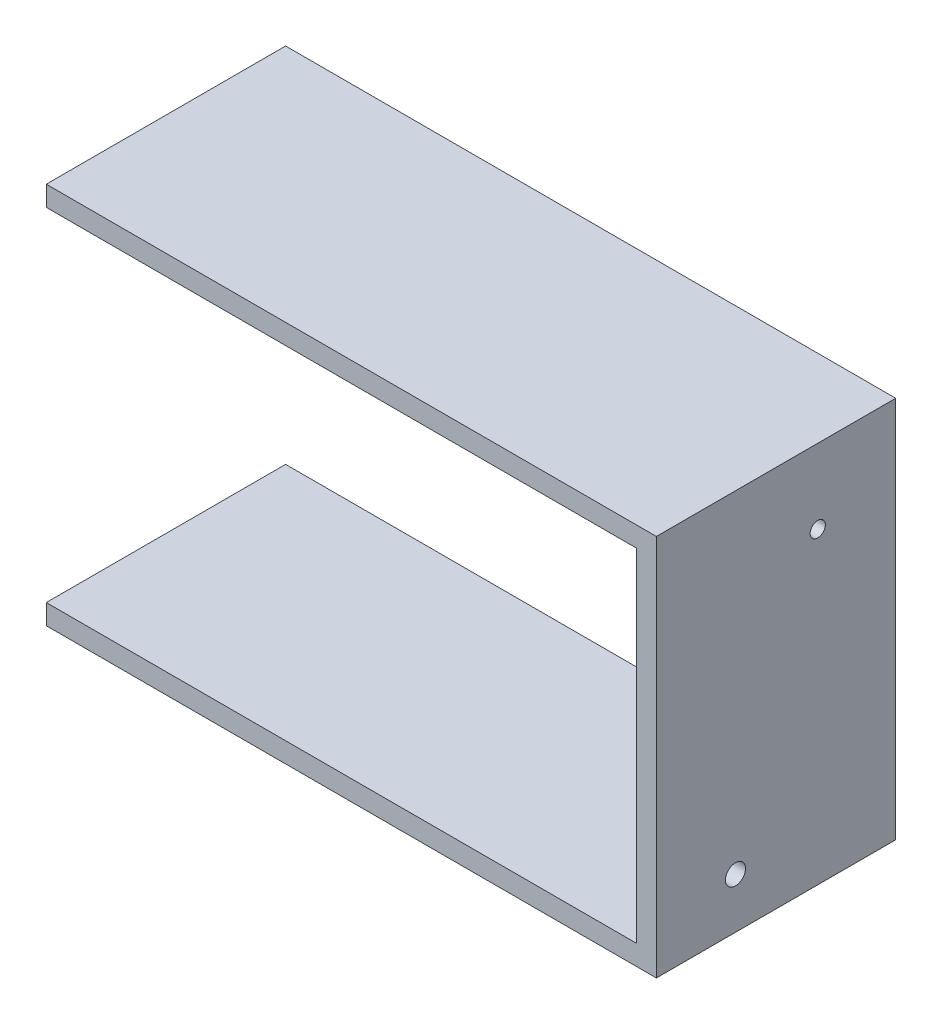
SolidWorks part; units mm, degrees
ref_plane "Alzado" through (0, 0, 0) normal (0, 0, 1) x (1, 0, 0)
ref_plane "Planta" through (0, 0, 0) normal (0, 1, 0) x (1, 0, 0)
ref_plane "Vista lateral" through (0, 0, 0) normal (1, 0, 0) x (0, 0, -1)
sketch "Croquis1" plane through (0, 0, 0) normal (0, 0, 1) x (1, 0, 0)
  line L0 (0, 0) -> (1191.5, 0)
  line L1 (1191.5, 0) -> (1191.5, 723)
  line L2 (0, 723) -> (1191.5, 723)
  line L3 (0, 0) -> (0, 723)
  line L6 (38, 38) -> (38, 685)
  line L11 (38, 38) -> (1153.5, 38)
  line L12 (1153.5, 38) -> (1153.5, 685)
  line L13 (38, 685) -> (1153.5, 685)
  dimension "D1" = 723
  dimension "D2" = 1191.5
  dimension "D3" = 38
extrude "Saliente-Extruir1" add sketch "Croquis1" along normal blind 452.5
sketch "Croquis9" plane through (1191.5, 0, 0) normal (1, 0, 0) x (0, 0, -1)
  circle A0 centre (-303, 95) radius 19
  circle A1 centre (-147.425, 582.452) radius 14.35
  dimension "D5" = 38
  dimension "D6" = 28.7
  dimension "D1" = 149.5
  dimension "D2" = 95
  dimension "D3" = 147.425
  dimension "D4" = 140.548
extrude "Cortar-Extruir2" cut sketch "Croquis9" against normal blind 38
sketch "Croquis14" plane through (0, 0, 0) normal (-1, 0, 0) x (0, 0, 1)
  circle A0 centre (10.25, 711.75) radius 4.7625
  circle A1 centre (46.25, 711.75) radius 4.7625
  circle A2 centre (82.25, 711.75) radius 4.7625
  circle A3 centre (118.25, 711.75) radius 4.7625
  circle A4 centre (154.25, 711.75) radius 4.7625
  circle A5 centre (190.25, 711.75) radius 4.7625
  circle A6 centre (226.25, 711.75) radius 4.7625
  circle A7 centre (262.25, 711.75) radius 4.7625
  circle A8 centre (298.25, 711.75) radius 4.7625
  circle A9 centre (334.25, 711.75) radius 4.7625
  circle A10 centre (370.25, 711.75) radius 4.7625
  circle A11 centre (406.25, 711.75) radius 4.7625
  circle A12 centre (442.25, 711.75) radius 4.7625
  circle A13 centre (10.25, 676.75) radius 4.7625
  circle A14 centre (10.25, 641.75) radius 4.7625
  circle A15 centre (10.25, 606.75) radius 4.7625
  circle A16 centre (10.25, 571.75) radius 4.7625
  circle A17 centre (10.25, 536.75) radius 4.7625
  circle A18 centre (10.25, 501.75) radius 4.7625
  circle A19 centre (10.25, 466.75) radius 4.7625
  circle A20 centre (10.25, 431.75) radius 4.7625
  circle A21 centre (10.25, 396.75) radius 4.7625
  circle A22 centre (10.25, 361.75) radius 4.7625
  circle A23 centre (10.25, 326.75) radius 4.7625
  circle A24 centre (10.25, 291.75) radius 4.7625
  circle A25 centre (10.25, 256.75) radius 4.7625
  circle A26 centre (10.25, 221.75) radius 4.7625
  circle A27 centre (10.25, 186.75) radius 4.7625
  circle A28 centre (10.25, 151.75) radius 4.7625
  circle A29 centre (10.25, 116.75) radius 4.7625
  circle A30 centre (10.25, 81.75) radius 4.7625
  circle A31 centre (10.25, 46.75) radius 4.7625
  circle A32 centre (10.25, 11.75) radius 4.7625
  circle A33 centre (46.25, 11.75) radius 4.7625
  circle A34 centre (82.25, 11.75) radius 4.7625
  circle A35 centre (118.25, 11.75) radius 4.7625
  circle A36 centre (154.25, 11.75) radius 4.7625
  circle A37 centre (190.25, 11.75) radius 4.7625
  circle A38 centre (226.25, 11.75) radius 4.7625
  circle A39 centre (262.25, 11.75) radius 4.7625
  circle A40 centre (298.25, 11.75) radius 4.7625
  circle A41 centre (334.25, 11.75) radius 4.7625
  circle A42 centre (370.25, 11.75) radius 4.7625
  circle A43 centre (406.25, 11.75) radius 4.7625
  circle A44 centre (442.25, 11.75) radius 4.7625
  circle A45 centre (442.25, 46.75) radius 4.7625
  circle A46 centre (442.25, 81.75) radius 4.7625
  circle A47 centre (442.25, 116.75) radius 4.7625
  circle A48 centre (442.25, 151.75) radius 4.7625
  circle A49 centre (442.25, 186.75) radius 4.7625
  circle A50 centre (442.25, 221.75) radius 4.7625
  circle A51 centre (442.25, 256.75) radius 4.7625
  circle A52 centre (442.25, 291.75) radius 4.7625
  circle A53 centre (442.25, 326.75) radius 4.7625
  circle A54 centre (442.25, 361.75) radius 4.7625
  circle A55 centre (442.25, 396.75) radius 4.7625
  circle A56 centre (442.25, 431.75) radius 4.7625
  circle A57 centre (442.25, 466.75) radius 4.7625
  circle A58 centre (442.25, 501.75) radius 4.7625
  circle A59 centre (442.25, 536.75) radius 4.7625
  circle A60 centre (442.25, 571.75) radius 4.7625
  circle A61 centre (442.25, 606.75) radius 4.7625
  circle A62 centre (442.25, 641.75) radius 4.7625
  circle A63 centre (442.25, 676.75) radius 4.7625
  dimension "D1" = 9.525
  dimension "D2" = 10.25
  dimension "D3" = 11.25
  dimension "D5" = 21
  dimension "D6" = 13
  dimension "D7" = 35
  dimension "D4" = 13
  dimension "D8" = 20
extrude "Cortar-Extruir3" cut sketch "Croquis14" against normal blind 70
sketch "Croquis17" plane through (0, 0, 452.5) normal (0, 0, 1) x (1, 0, 0)
  line L0 (0, 0) -> (38, 0)
  line L1 (0, 0) -> (1191.5, 0) construction
  line L2 (38, 0) -> (38, 723)
  line L3 (1191.5, 723) -> (0, 723) construction
  line L4 (38, 723) -> (0, 723)
  line L5 (0, 723) -> (0, 0)
  dimension "D1" = 38
extrude "Cortar-Extruir4" cut sketch "Croquis17" against normal up to next
